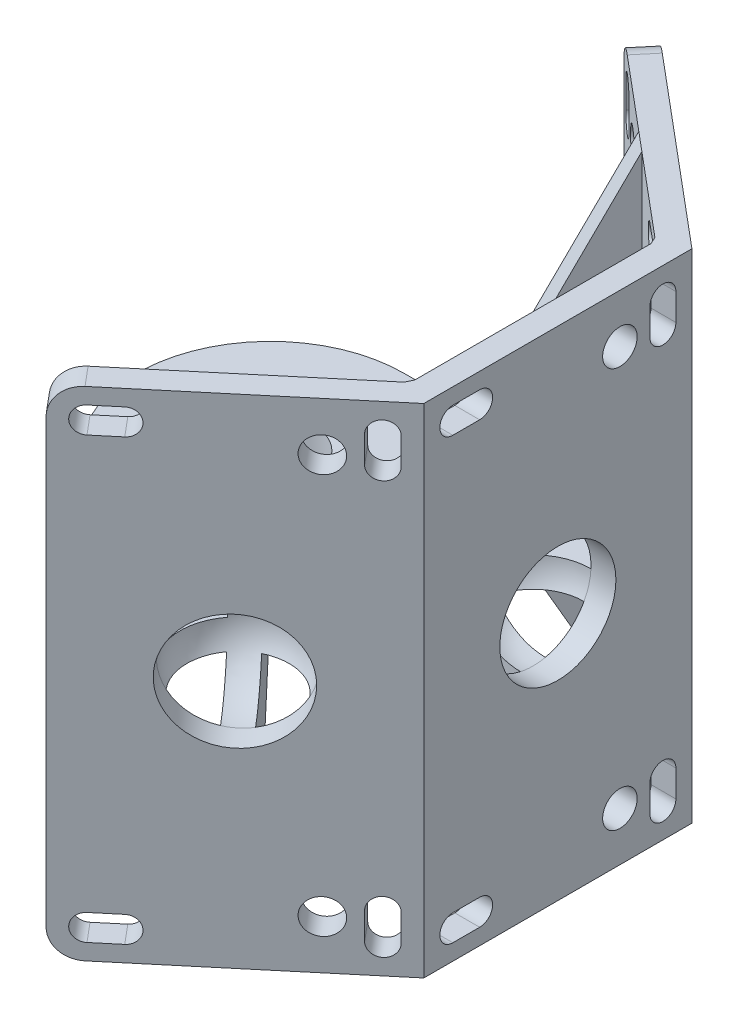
SolidWorks part; units mm, degrees
ref_plane "Front Plane" through (0, 0, 0) normal (0, 0, 1) x (1, 0, 0)
ref_plane "Top Plane" through (0, 0, 0) normal (0, 1, 0) x (1, 0, 0)
ref_plane "Right Plane" through (0, 0, 0) normal (1, 0, 0) x (0, 0, -1)
sketch "Sketch1" plane through (0, 0, 0) normal (0, 1, 0) x (1, 0, 0)
  line L1 (0, 12.2936) -> (18.1864, 12.2936)
  line L3 (0, -12.2936) -> (18.1864, -12.2936)
  line L4 (18.1864, 12.2936) -> (18.1864, -12.2936)
  arc A0 (0, 12.2936) -> (0, -12.2936) centre (0, 0) ccw
  circle A1 centre (0, 0) radius 4.0005
  circle A2 centre (0, 8.3312) radius 1.1938
  circle A3 centre (-8.3312, 0) radius 1.1938
  circle A4 centre (0, -8.3312) radius 1.1938
  circle A5 centre (8.3312, 0) radius 1.1938
  dimension "D1" = 18.1864
  dimension "D3" = 8.001
  dimension "D4" = 2.3876
  dimension "D5" = 2.3876
  dimension "D6" = 2.3876
  dimension "D7" = 2.3876
  dimension "D2" = 24.5872
  dimension "D8" = 8.3312
  dimension "D9" = 8.3312
  dimension "D10" = 8.3312
  dimension "D11" = 8.3312
extrude "base" add sketch "Sketch1" along normal blind 2.286
sketch "Sketch3" plane through (0, 0, 0) normal (0, 1, 0) x (1, 0, 0)
  line L0 (7.5444, 28.156) -> (6.075, 26.4048)
  line L1 (26.4182, -12.319) -> (26.4182, 12.319)
  line L2 (6.075, 26.4048) -> (24.1322, 11.253)
  line L4 (7.5444, 28.156) -> (26.4182, 12.319)
  line L5 (26.4182, -12.319) -> (7.5444, -28.156)
  line L7 (26.4182, 0) -> (0, 0) construction
  line L8 (16.9813, 20.2375) -> (0, 0) construction
  line L9 (16.9813, -20.2375) -> (0, 0) construction
  line L10 (24.1322, 11.253) -> (24.1322, -11.253)
  line L14 (24.1322, -11.253) -> (6.075, -26.4048)
  line L16 (6.075, -26.4048) -> (7.5444, -28.156)
  circle A0 centre (0, 0) radius 4.0005 construction
  dimension "D1" = 24.638
  dimension "D2" = 24.638
  dimension "D3" = 24.638
  dimension "D4" = 50
  dimension "D5" = 2.286
  dimension "D6" = 2.286
  dimension "D7" = 2.286
extrude "cover" add sketch "Sketch3" along normal blind 25.4 separate body
sketch "Sketch4" plane through (0, 0, 0) normal (0, -1, 0) x (1, 0, 0)
  line L0 (6.075, -26.4048) -> (6.075, -12.2936)
  line L1 (18.1864, -12.2936) -> (0, -12.2936) construction
  line L2 (6.075, -12.2936) -> (18.1864, -12.2936)
  line L3 (18.1864, -12.2936) -> (18.1864, 12.2936)
  line L4 (18.1864, 12.2936) -> (6.075, 12.2936)
  line L5 (0, 12.2936) -> (18.1864, 12.2936) construction
  line L6 (6.075, 12.2936) -> (6.075, 26.4048)
  line L7 (6.075, 26.4048) -> (24.1322, 11.253)
  line L8 (24.1322, 11.253) -> (24.1322, -11.253)
  line L9 (24.1322, -11.253) -> (6.075, -26.4048)
extrude "base close" add sketch "Sketch4" against normal blind 2.286
sketch "Sketch6" plane through (0, 0, 0) normal (0, -1, 0) x (1, 0, 0)
  line L0 (7.5444, 28.156) -> (26.4182, 12.319)
  line L1 (26.4182, 12.319) -> (26.4182, -12.319)
  line L2 (26.4182, -12.319) -> (7.5444, -28.156)
  line L3 (7.5444, -28.156) -> (6.075, -26.4048)
  line L4 (6.075, -26.4048) -> (24.1322, -11.253)
  line L5 (24.1322, -11.253) -> (24.1322, 11.253)
  line L6 (24.1322, 11.253) -> (6.075, 26.4048)
  line L7 (6.075, 26.4048) -> (7.5444, 28.156)
  dimension "D1" = 2.286
extrude "Boss-Extrude5" add sketch "Sketch6" along normal blind 20.32
sketch "Sketch7" plane through (26.4182, 0, 0) normal (1, 0, 0) x (0, 0, -1)
  line L0 (-12.319, 25.4) -> (12.319, 25.4) construction
  line L1 (12.319, 25.4) -> (12.319, -20.32) construction
  line L2 (8.4582, 22.733) -> (8.4582, 20.2692)
  line L3 (-12.319, 25.4) -> (-12.319, -20.32) construction
  line L4 (-9.652, 23.9268) -> (-7.1882, 23.9268)
  line L5 (12.319, -20.32) -> (-12.319, -20.32) construction
  line L6 (-7.1882, 21.5392) -> (-9.652, 21.5392)
  line L7 (-9.652, -16.4592) -> (-7.1882, -16.4592)
  line L8 (8.4582, -15.1892) -> (8.4582, -17.653)
  line L9 (-7.1882, -18.8468) -> (-9.652, -18.8468)
  line L10 (10.8458, 20.2692) -> (10.8458, 22.733)
  line L12 (10.8458, -17.653) -> (10.8458, -15.1892)
  circle A0 centre (0, 2.54) radius 5.334
  circle A1 centre (5.7023, 20.9169) radius 1.5875
  arc A2 (10.8458, 22.733) -> (8.4582, 22.733) centre (9.652, 22.733) ccw
  arc A3 (8.4582, 20.2692) -> (10.8458, 20.2692) centre (9.652, 20.2692) ccw
  arc A4 (10.8458, -15.1892) -> (8.4582, -15.1892) centre (9.652, -15.1892) ccw
  arc A5 (8.4582, -17.653) -> (10.8458, -17.653) centre (9.652, -17.653) ccw
  circle A6 centre (5.7023, -15.8369) radius 1.5875
  arc A7 (-9.652, 23.9268) -> (-9.652, 21.5392) centre (-9.652, 22.733) ccw
  arc A8 (-7.1882, 21.5392) -> (-7.1882, 23.9268) centre (-7.1882, 22.733) ccw
  arc A9 (-9.652, -16.4592) -> (-9.652, -18.8468) centre (-9.652, -17.653) ccw
  arc A10 (-7.1882, -18.8468) -> (-7.1882, -16.4592) centre (-7.1882, -17.653) ccw
  dimension "D1" = 10.668
  dimension "D5" = 2.3876
  dimension "D10" = 2.3876
  dimension "D14" = 2.3876
  dimension "D18" = 1.4732
  dimension "D20" = 3.175
  dimension "D2" = 22.86
  dimension "D3" = 12.319
  dimension "D4" = 2.667
  dimension "D6" = 2.4638
  dimension "D7" = 2.667
  dimension "D8" = 2.667
  dimension "D9" = 2.667
  dimension "D11" = 2.4638
  dimension "D12" = 2.667
  dimension "D13" = 2.667
  dimension "D15" = 2.4638
  dimension "D16" = 2.667
  dimension "D17" = 2.667
  dimension "D19" = 2.4638
  dimension "D21" = 6.6167
  dimension "D22" = 4.4831
  dimension "D23" = 4.4831
extrude "Cut-Extrude1" cut sketch "Sketch7" against normal blind 2.286
sketch "Sketch19" plane through (16.9813, 0, -20.2375) normal (0.6428, 0, -0.766) x (-0.766, 0, -0.6428)
  line L0 (-12.319, 25.4) -> (12.319, 25.4) construction
  line L1 (12.319, 25.4) -> (12.319, -20.32) construction
  line L2 (-12.319, 25.4) -> (-12.319, -20.32) construction
  line L3 (-9.652, 23.9268) -> (-7.1882, 23.9268)
  line L4 (10.8458, 22.733) -> (10.8458, 20.2692)
  line L5 (-9.652, 21.5392) -> (-7.1882, 21.5392)
  line L6 (12.319, -20.32) -> (-12.319, -20.32) construction
  line L7 (8.4582, 22.733) -> (8.4582, 20.2692)
  line L8 (8.4582, -15.1892) -> (8.4582, -17.653)
  line L9 (10.8458, -15.1892) -> (10.8458, -17.653)
  line L10 (-9.652, -16.4592) -> (-7.1882, -16.4592)
  line L11 (-9.652, -18.8468) -> (-7.1882, -18.8468)
  circle A0 centre (0, 2.54) radius 5.334
  arc A1 (-9.652, 23.9268) -> (-9.652, 21.5392) centre (-9.652, 22.733) ccw
  arc A2 (-7.1882, 21.5392) -> (-7.1882, 23.9268) centre (-7.1882, 22.733) ccw
  arc A3 (10.8458, 22.733) -> (8.4582, 22.733) centre (9.652, 22.733) ccw
  arc A4 (8.4582, 20.2692) -> (10.8458, 20.2692) centre (9.652, 20.2692) ccw
  arc A5 (10.8458, -15.1892) -> (8.4582, -15.1892) centre (9.652, -15.1892) ccw
  arc A6 (8.4582, -17.653) -> (10.8458, -17.653) centre (9.652, -17.653) ccw
  arc A7 (-7.1882, -18.8468) -> (-7.1882, -16.4592) centre (-7.1882, -17.653) ccw
  arc A8 (-9.652, -16.4592) -> (-9.652, -18.8468) centre (-9.652, -17.653) ccw
  circle A9 centre (5.7023, 20.9169) radius 1.5875
  circle A10 centre (5.7023, -15.8369) radius 1.5875
  dimension "D1" = 10.668
  dimension "D4" = 2.3876
  dimension "D10" = 2.3876
  dimension "D12" = 2.3876
  dimension "D18" = 2.3876
  dimension "D20" = 3.175
  dimension "D2" = 22.86
  dimension "D3" = 12.319
  dimension "D5" = 2.667
  dimension "D6" = 2.667
  dimension "D7" = 2.4638
  dimension "D8" = 2.667
  dimension "D9" = 2.667
  dimension "D11" = 2.4638
  dimension "D13" = 2.667
  dimension "D14" = 2.667
  dimension "D15" = 2.4638
  dimension "D16" = 2.667
  dimension "D17" = 2.667
  dimension "D19" = 2.4638
  dimension "D21" = 6.6167
  dimension "D22" = 4.4831
  dimension "D23" = 4.4831
extrude "Cut-Extrude10" cut sketch "Sketch19" against normal blind 2.286
sketch "Sketch21" plane through (16.9813, 0, 20.2375) normal (0.6428, 0, 0.766) x (0.766, 0, -0.6428)
  line L0 (-12.319, 25.4) -> (12.319, 25.4) construction
  line L1 (-12.319, 25.4) -> (-12.319, -20.32) construction
  line L2 (-9.652, 23.9268) -> (-7.1882, 23.9268)
  line L3 (12.319, 25.4) -> (12.319, -20.32) construction
  line L4 (-7.1882, 21.5392) -> (-9.652, 21.5392)
  line L5 (8.4582, 22.733) -> (8.4582, 20.2692)
  line L7 (10.8458, 20.2692) -> (10.8458, 22.733)
  line L8 (12.319, -20.32) -> (-12.319, -20.32) construction
  line L9 (8.4582, -15.1892) -> (8.4582, -17.653)
  line L10 (-9.652, -18.8468) -> (-7.1882, -18.8468)
  line L11 (10.8458, -17.653) -> (10.8458, -15.1892)
  line L12 (-9.652, -16.4592) -> (-7.1882, -16.4592)
  arc A0 (-9.652, 23.9268) -> (-9.652, 21.5392) centre (-9.652, 22.733) ccw
  arc A1 (-7.1882, 21.5392) -> (-7.1882, 23.9268) centre (-7.1882, 22.733) ccw
  arc A2 (10.8458, 22.733) -> (8.4582, 22.733) centre (9.652, 22.733) ccw
  arc A3 (8.4582, 20.2692) -> (10.8458, 20.2692) centre (9.652, 20.2692) ccw
  arc A4 (8.4582, -17.653) -> (10.8458, -17.653) centre (9.652, -17.653) ccw
  arc A5 (10.8458, -15.1892) -> (8.4582, -15.1892) centre (9.652, -15.1892) ccw
  arc A6 (-7.1882, -18.8468) -> (-7.1882, -16.4592) centre (-7.1882, -17.653) ccw
  arc A7 (-9.652, -16.4592) -> (-9.652, -18.8468) centre (-9.652, -17.653) ccw
  circle A8 centre (5.7023, 20.9169) radius 1.5875
  circle A9 centre (5.7023, -15.8369) radius 1.5875
  circle A10 centre (0, 2.54) radius 5.334
  dimension "D1" = 2.3876
  dimension "D7" = 2.3876
  dimension "D11" = 2.3876
  dimension "D18" = 3.175
  dimension "D21" = 3.175
  dimension "D24" = 10.668
  dimension "D2" = 2.667
  dimension "D3" = 2.667
  dimension "D4" = 2.4638
  dimension "D5" = 2.667
  dimension "D6" = 2.667
  dimension "D8" = 2.4638
  dimension "D9" = 2.667
  dimension "D10" = 2.667
  dimension "D12" = 2.4638
  dimension "D13" = 2.667
  dimension "D14" = 2.667
  dimension "D16" = 2.4638
  dimension "D17" = 2.3876
  dimension "D19" = 6.6167
  dimension "D20" = 4.4831
  dimension "D22" = 4.4831
  dimension "D23" = 6.6167
  dimension "D25" = 22.86
  dimension "D26" = 12.319
extrude "Cut-Extrude12" cut sketch "Sketch21" against normal blind 2.286
sketch "Sketch23" plane through (0, 0, 0) normal (0, -1, 0) x (1, 0, 0)
  line L0 (15.5119, 18.4863) -> (0, 0) construction
  line L1 (19.1049, -15.4714) -> (11.9188, -21.5013) construction
  line L2 (0, 0) -> (15.5119, -18.4863) construction
  line L3 (24.1322, 4.6904) -> (24.1322, -4.6904) construction
  line L4 (0, 0) -> (24.1322, 0) construction
  line L5 (11.9188, 21.5013) -> (19.1049, 15.4714) construction
  line L6 (16.3875, 17.7516) -> (14.6363, 19.221)
  line L7 (24.1322, 1.143) -> (12.7022, 1.143)
  line L8 (24.1322, 1.143) -> (24.1322, -1.143)
  line L9 (24.1322, -1.143) -> (12.7022, -1.143)
  line L10 (12.7022, 1.143) -> (12.7022, -1.143)
  line L11 (16.3875, 17.7516) -> (9.0404, 8.9957)
  line L12 (9.0404, 8.9957) -> (7.2892, 10.4651)
  line L13 (7.2892, 10.4651) -> (14.6363, 19.221)
  line L14 (14.6363, -19.221) -> (16.3875, -17.7516)
  line L15 (14.6363, -19.221) -> (7.2892, -10.4651)
  line L16 (7.2892, -10.4651) -> (9.0404, -8.9957)
  line L17 (9.0404, -8.9957) -> (16.3875, -17.7516)
  line L20 (24.1322, 11.253) -> (24.1322, -11.253) construction
  dimension "D1" = 2.286
  dimension "D2" = 11.43
  dimension "D3" = 2.286
  dimension "D4" = 2.286
  dimension "D5" = 11.43
  dimension "D6" = 11.43
extrude "Boss-Extrude7" add sketch "Sketch23" along normal blind 20.32
sketch "Sketch28" plane through (0, 2.286, 0) normal (0, 1, 0) x (1, 0, 0)
  line L0 (24.1322, 0) -> (0, 0) construction
  line L1 (24.1322, 5.3279) -> (24.1322, -5.3279) construction
  line L2 (0, 0) -> (15.5119, 18.4863) construction
  line L3 (11.4304, 21.9111) -> (19.5933, 15.0616) construction
  line L4 (0, 0) -> (15.5119, -18.4863) construction
  line L5 (19.5933, -15.0616) -> (11.4304, -21.9111) construction
  line L6 (16.3875, 17.7516) -> (14.6363, 19.221)
  line L7 (24.1322, 1.143) -> (12.7022, 1.143)
  line L8 (24.1322, 1.143) -> (24.1322, -1.143)
  line L9 (24.1322, -1.143) -> (12.7022, -1.143)
  line L10 (12.7022, 1.143) -> (12.7022, -1.143)
  line L11 (14.6363, 19.221) -> (7.2892, 10.4651)
  line L12 (7.2892, 10.4651) -> (9.0404, 8.9957)
  line L13 (9.0404, 8.9957) -> (16.3875, 17.7516)
  line L14 (14.6363, -19.221) -> (16.3875, -17.7516)
  line L15 (16.3875, -17.7516) -> (9.0404, -8.9957)
  line L16 (9.0404, -8.9957) -> (7.2892, -10.4651)
  line L17 (7.2892, -10.4651) -> (14.6363, -19.221)
  dimension "D1" = 2.286
  dimension "D2" = 11.43
  dimension "D3" = 2.286
  dimension "D4" = 11.43
  dimension "D5" = 2.286
  dimension "D6" = 11.43
extrude "Boss-Extrude8" add sketch "Sketch28" along normal blind 23.114
sketch "Sketch29" plane through (-0.8756, 0, 0.7347) normal (-0.766, 0, 0.6428) x (0.6428, 0, 0.766)
  line L0 (24.1322, 25.4) -> (12.7022, 2.286)
  line L1 (12.7022, 2.286) -> (12.7022, 25.4)
  line L2 (12.7022, 25.4) -> (24.1322, 25.4)
extrude "Cut-Extrude19" cut sketch "Sketch29" against normal blind 2.286
sketch "Sketch31" plane through (0, 0, 1.143) normal (0, 0, 1) x (1, 0, 0)
  line L0 (24.1322, 25.4) -> (12.7022, 2.286)
  line L1 (12.7022, 2.286) -> (12.7022, 25.4)
  line L2 (12.7022, 25.4) -> (24.1322, 25.4)
extrude "Cut-Extrude21" cut sketch "Sketch31" against normal blind 2.286
sketch "Sketch32" plane through (0.8756, 0, 0.7347) normal (0.766, 0, 0.6428) x (0.6428, 0, -0.766)
  line L0 (12.7022, 2.286) -> (24.1322, 25.4)
  line L1 (24.1322, 25.4) -> (12.7022, 25.4)
  line L2 (12.7022, 25.4) -> (12.7022, 2.286)
extrude "Cut-Extrude22" cut sketch "Sketch32" against normal blind 2.286
sketch "Sketch33" plane through (-0.8756, 0, -0.7347) normal (-0.766, 0, -0.6428) x (-0.6428, 0, 0.766)
  line L0 (-12.7022, 0) -> (-24.1322, -20.32)
  line L1 (-24.1322, -20.32) -> (-12.7022, -20.32)
  line L2 (-12.7022, -20.32) -> (-12.7022, 0)
extrude "Cut-Extrude23" cut sketch "Sketch33" against normal blind 2.286
sketch "Sketch34" plane through (0, 0, -1.143) normal (0, 0, -1) x (-1, 0, 0)
  line L0 (-12.7022, 0) -> (-24.1322, -20.32)
  line L1 (-24.1322, -20.32) -> (-12.7022, -20.32)
  line L2 (-12.7022, -20.32) -> (-12.7022, 0)
extrude "Cut-Extrude24" cut sketch "Sketch34" against normal blind 2.286
sketch "Sketch35" plane through (0.8756, 0, -0.7347) normal (0.766, 0, -0.6428) x (-0.6428, 0, -0.766)
  line L0 (-12.7022, 0) -> (-24.1322, -20.32)
  line L1 (-24.1322, -20.32) -> (-12.7022, -20.32)
  line L2 (-12.7022, -20.32) -> (-12.7022, 0)
extrude "Cut-Extrude25" cut sketch "Sketch35" against normal blind 2.286
sketch "Sketch37" plane through (24.1322, 0, 0) normal (1, 0, 0) x (0, 0, -1)
  line L0 (0, 7.874) -> (0, -2.794)
  arc A0 (0, -2.794) -> (0, 7.874) centre (0, 2.54) ccw
  arc A1 (-5.3279, 2.286) -> (-4.6904, 0) centre (0, 2.54) ccw construction
revolve "Cut-Revolve2" cut sketch "Sketch37" angle 360 about L0
sketch "Sketch38" plane through (15.5119, 0, 18.4863) normal (0.6428, 0, 0.766) x (0.766, 0, -0.6428)
  line L0 (0, 7.874) -> (0, -2.794)
  arc A0 (0, -2.794) -> (0, 7.874) centre (0, 2.54) ccw
  arc A1 (-5.3279, 2.286) -> (-4.6904, 0) centre (0, 2.54) ccw construction
revolve "Cut-Revolve3" cut sketch "Sketch38" angle 360 about L0
sketch "Sketch39" plane through (15.5119, 0, -18.4863) normal (0.6428, 0, -0.766) x (-0.766, 0, -0.6428)
  line L0 (0, 7.874) -> (0, -2.794)
  arc A0 (0, -2.794) -> (0, 7.874) centre (0, 2.54) ccw
  arc A1 (-5.3279, 2.286) -> (-4.6904, 0) centre (0, 2.54) ccw construction
revolve "Cut-Revolve4" cut sketch "Sketch39" angle 360 about L0
fillet "Fillet1" radius 2.54 1 edges at (6.8097, 25.4, 27.2804)
fillet "Fillet2" radius 2.54 1 edges at (6.8097, 25.4, -27.2804)
fillet "Fillet3" radius 2.54 1 edges at (6.8097, -20.32, -27.2804)
fillet "Fillet4" radius 2.54 1 edges at (6.8097, -20.32, 27.2804)
sketch "Sketch42" plane through (0, 25.4, 0) normal (0, 1, 0) x (1, 0, 0)
  line L0 (23.8209, 11.5142) -> (24.1322, 11.253)
  line L1 (16.3875, 17.7516) -> (24.1322, 11.253) construction
  line L2 (24.1322, 11.253) -> (24.1322, 10.8466)
  line L3 (24.1322, 11.253) -> (24.1322, 1.143) construction
  line L4 (24.1322, 10.8466) -> (23.8209, 11.5142)
  dimension "D1" = 0.4064
  dimension "D2" = 0.4064
extrude "Boss-Extrude9" add sketch "Sketch42" against normal blind 45.72
sketch "Sketch43" plane through (0, 25.4, 0) normal (0, 1, 0) x (1, 0, 0)
  line L0 (23.8209, -11.5142) -> (24.1322, -11.253)
  line L1 (24.1322, -11.253) -> (16.3875, -17.7516) construction
  line L2 (24.1322, -11.253) -> (24.1322, -10.8466)
  line L3 (24.1322, -1.143) -> (24.1322, -11.253) construction
  line L4 (24.1322, -10.8466) -> (23.8209, -11.5142)
  dimension "D1" = 0.4064
  dimension "D2" = 0.4064
extrude "Boss-Extrude10" add sketch "Sketch43" against normal blind 45.72
